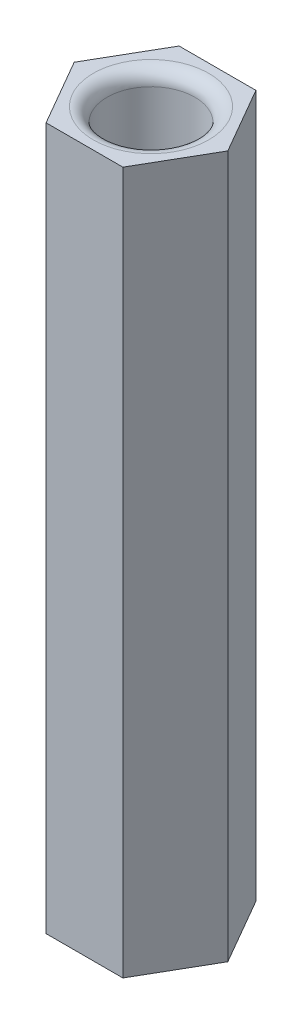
SolidWorks part; units mm, degrees
other "<MecanumSpacer.0002>-<Imported1>"
ref_plane "Front Plane" through (0, 0, 0) normal (0, 0, 1) x (1, 0, 0)
ref_plane "Top Plane" through (0, 0, 0) normal (0, 1, 0) x (1, 0, 0)
ref_plane "Right Plane" through (0, 0, 0) normal (1, 0, 0) x (0, 0, -1)
mirrored part "MecanumSpacer.0002_Mirrored"
